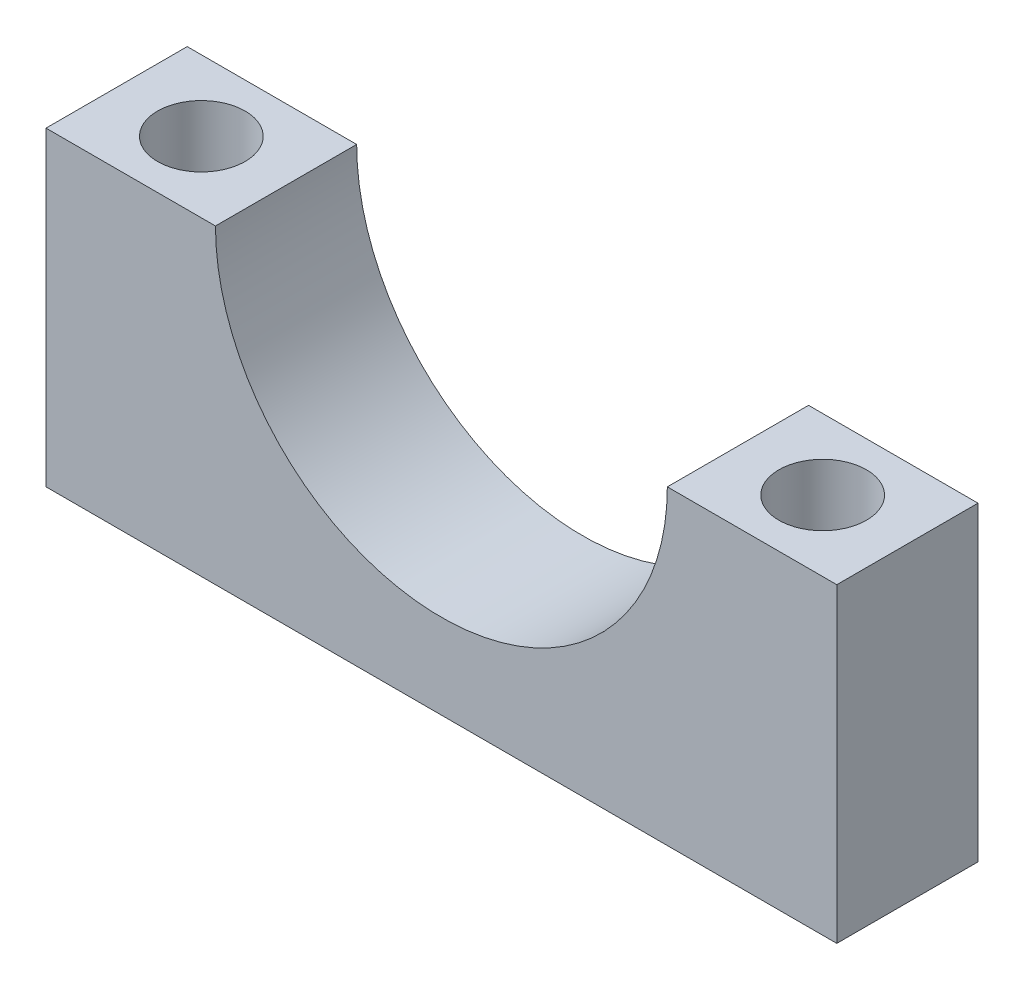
SolidWorks part; units mm, degrees
ref_plane "前视基准面" through (0, 0, 0) normal (0, 0, 1) x (1, 0, 0)
ref_plane "上视基准面" through (0, 0, 0) normal (0, 1, 0) x (1, 0, 0)
ref_plane "右视基准面" through (0, 0, 0) normal (1, 0, 0) x (0, 0, -1)
other "Configuration Table"
sketch "草图1" plane through (0, 0, 0) normal (0, 0, 1) x (1, 0, 0)
  line L1 (-14, 5.5) -> (14, 5.5) construction
  line L2 (-14, 5.5) -> (-14, -5.5) construction
  line L3 (-14, -5.5) -> (14, -5.5) construction
  line L4 (14, 5.5) -> (14, -5.5) construction
  line L5 (-14, 5.5) -> (14, -5.5) construction
  line L6 (-14, -5.5) -> (14, 5.5) construction
  line L7 (-8, 5.5) -> (-14, 5.5)
  line L8 (-14, 5.5) -> (-14, -5.5)
  line L9 (-14, -5.5) -> (14, -5.5)
  line L10 (14, -5.5) -> (14, 5.5)
  line L11 (14, 5.5) -> (8, 5.5)
  arc A0 (8, 5.5) -> (-8, 5.5) centre (0, 5.5) cw
  point P0 (0, 0)
extrude "凸台-拉伸1" add sketch "草图1" along normal blind 5
sketch "草图2" plane through (0, -5.5, 0) normal (0, -1, 0) x (1, 0, 0)
  line L0 (-14, 2.5) -> (14, 2.5) construction
  line L1 (-14, 5) -> (-14, 0) construction
  line L2 (14, 5) -> (14, 0) construction
  circle A0 centre (0, 2.5) radius 11 construction
  circle A1 centre (-11, 2.5) radius 1.55
  circle A2 centre (11, 2.5) radius 1.55
extrude "切除-拉伸1" cut sketch "草图2" against normal through all
